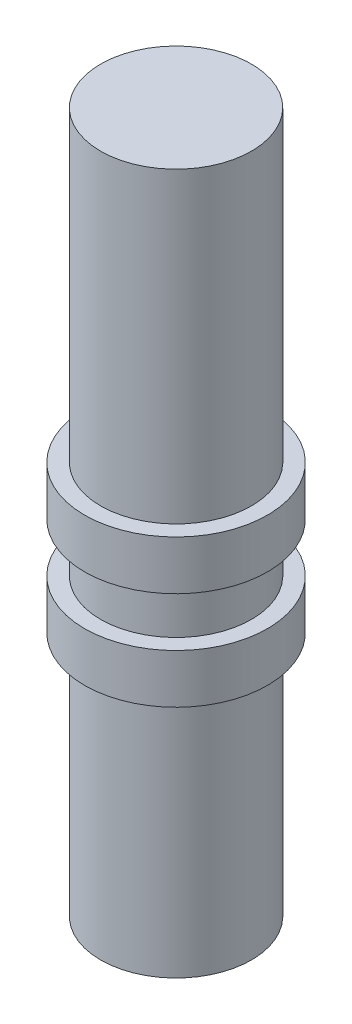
SolidWorks part; units mm, degrees
ref_plane "Front" through (0, 0, 0) normal (0, 0, 1) x (1, 0, 0)
ref_plane "Top" through (0, 0, 0) normal (0, 1, 0) x (1, 0, 0)
ref_plane "Right" through (0, 0, 0) normal (1, 0, 0) x (0, 0, -1)
sketch "Sketch2" plane through (0, 0, 0) normal (0, 1, 0) x (1, 0, 0)
  circle A0 centre (0, 0) radius 3.8989
  dimension "D1" = 7.7978
extrude "Boss-Extrude1" add sketch "Sketch2" along normal blind 12.7
sketch "Sketch3" plane through (0, 12.7, 0) normal (0, 1, 0) x (1, 0, 0)
  circle A0 centre (0, 0) radius 4.7244
  dimension "D1" = 9.4488
extrude "Boss-Extrude2" add sketch "Sketch3" along normal blind 2.54
sketch "Sketch4" plane through (0, 15.24, 0) normal (0, 1, 0) x (1, 0, 0)
  circle A0 centre (0, 0) radius 3.8989
  dimension "D1" = 7.7978
extrude "Boss-Extrude3" add sketch "Sketch4" along normal blind 2.54
sketch "Sketch5" plane through (0, 17.78, 0) normal (0, 1, 0) x (1, 0, 0)
  circle A0 centre (0, 0) radius 4.7244
  dimension "D1" = 9.4488
extrude "Boss-Extrude4" add sketch "Sketch5" along normal blind 2.54
sketch "Sketch6" plane through (0, 20.32, 0) normal (0, 1, 0) x (-1, 0, 0)
  circle A0 centre (0, 0) radius 3.8989
  dimension "D1" = 7.7978
extrude "Boss-Extrude5" add sketch "Sketch6" along normal blind 15.875
sketch "Sketch7" plane through (0, 0, 0) normal (0, -1, 0) x (1, 0, 0)
  circle A0 centre (0, 0) radius 3.175
  dimension "D1" = 6.35
extrude "Cut-Extrude1" cut sketch "Sketch7" against normal blind 6.35
